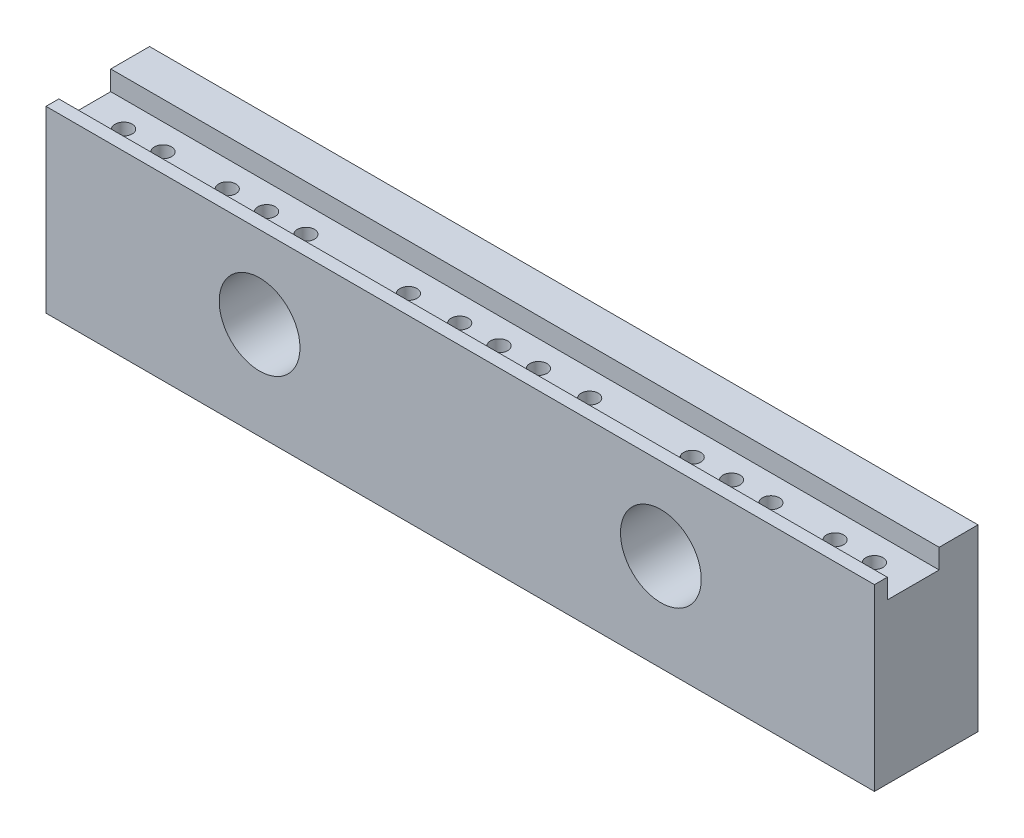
SolidWorks part; units mm, degrees
ref_plane "Front Plane" through (0, 0, 0) normal (0, 0, 1) x (1, 0, 0)
ref_plane "Top Plane" through (0, 0, 0) normal (0, 1, 0) x (1, 0, 0)
ref_plane "Right Plane" through (0, 0, 0) normal (1, 0, 0) x (0, 0, -1)
imported_body "Imported1"
other "DeleteFace1"
other "Move Face1" parameters "D1"=25.4
other "Move Face2" parameters "D1"=25.4
sketch "Sketch2" plane through (0, 39.116, 0) normal (0, 1, 0) x (1, 0, 0)
  line L0 (-101.6, 9.5123) -> (101.6, 9.5123) construction
  line L1 (-101.6, 3.1496) -> (-101.6, 15.875) construction
  line L2 (101.6, 15.875) -> (101.6, 3.1496) construction
  circle A0 centre (-92.075, 9.5123) radius 2.1
  circle A1 centre (82.423, 9.5123) radius 2.1
  circle A2 centre (92.075, 9.5123) radius 2.1
  circle A3 centre (-82.423, 9.5123) radius 2.1
  circle A4 centre (-66.675, 9.525) radius 2.1 construction
  dimension "D1" = 9.652
  dimension "D2" = 9.652
  dimension "D4" = 9.525
  dimension "D3" = 9.525
extrude "Cut-Extrude1" cut sketch "Sketch2" against normal up to vertex
